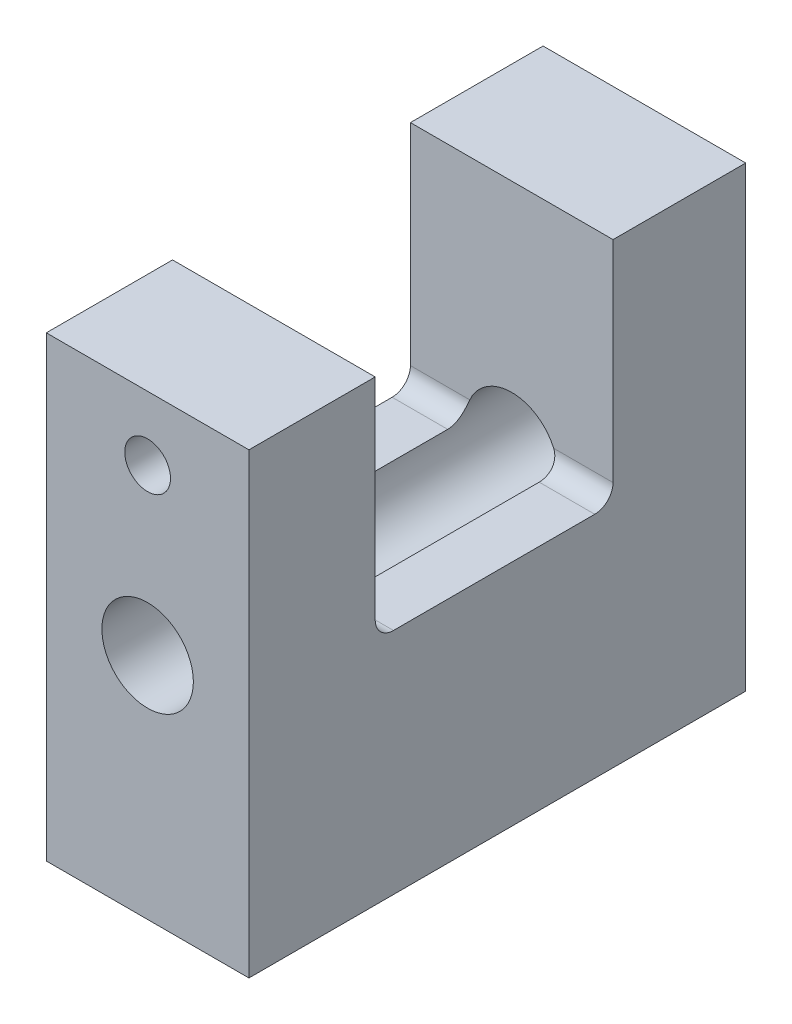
SolidWorks part; units mm, degrees
ref_plane "Plan1" through (0, 0, 0) normal (0, 0, 1) x (1, 0, 0)
ref_plane "Plan2" through (0, 0, 0) normal (0, 1, 0) x (1, 0, 0)
ref_plane "Plan3" through (0, 0, 0) normal (1, 0, 0) x (0, 0, -1)
sketch "Esquisse1" plane through (0, 0, 0) normal (0, 0, 1) x (1, 0, 0)
  line L0 (-50, 14) -> (20, 14) construction
  line L1 (-40, -30) -> (-17.85, -30)
  line L2 (-40, -30) -> (-40, 20)
  line L3 (-40, 20) -> (-17.85, 20)
  line L4 (-17.85, -30) -> (-17.85, 20)
  line L5 (-92.15, -5) -> (-2.15, -5) construction
  line L6 (-28.925, 20) -> (-28.925, -42.0336) construction
  circle A0 centre (-28.925, -5) radius 5
  dimension "D5" = 10
  dimension "D1" = 22.15
  dimension "D2" = 50
  dimension "D3" = 6
  dimension "D4" = 25
extrude "Base-Extrusion" add sketch "Esquisse1" along normal blind 54.3
sketch "Esquisse3" plane through (-17.85, 0, 0) normal (1, 0, 0) x (0, 0, -1)
  line L0 (-54.3, -5) -> (0, -5) construction
  line L1 (-40.5, 20) -> (-14.5, 20)
  line L2 (-40.5, 20) -> (-40.5, -5)
  line L3 (-40.5, -5) -> (-14.5, -5)
  line L4 (-14.5, 20) -> (-14.5, -5)
  line L5 (0, -30) -> (0, 20) construction
  dimension "D1" = 14.5
  dimension "D2" = 26
extrude "Enlèv. mat.-Extru.1" cut sketch "Esquisse3" against normal through all
fillet "Congé1" radius 2
sketch "Esquisse4" plane through (0, 0, 54.3) normal (0, 0, 1) x (1, 0, 0)
  line L0 (-43.4899, -5) -> (-6.4938, -5) construction
  line L1 (-50, 13) -> (-10, 13) construction
  line L2 (-28.925, 20) -> (-28.925, 8.0264) construction
  line L6 (-17.85, 20) -> (-40, 20) construction
  circle A0 centre (-28.925, 13) radius 2.5
  dimension "D2" = 5
  dimension "D1" = 18
extrude "Enlèv. mat.-Extru.2" cut sketch "Esquisse4" against normal blind 8
sketch "Esquisse5" plane through (0, 0, 0) normal (0, 0, -1) x (-1, 0, 0)
  line L0 (12.2706, -5) -> (47.0543, -5) construction
  line L1 (10, -23) -> (50, -23) construction
  line L2 (28.925, -20.9784) -> (28.925, -27.6155) construction
  circle A0 centre (28.925, -23) radius 2.5
  dimension "D2" = 5
  dimension "D1" = 18
extrude "Enlèv. mat.-Extru.3" cut sketch "Esquisse5" against normal blind 8
